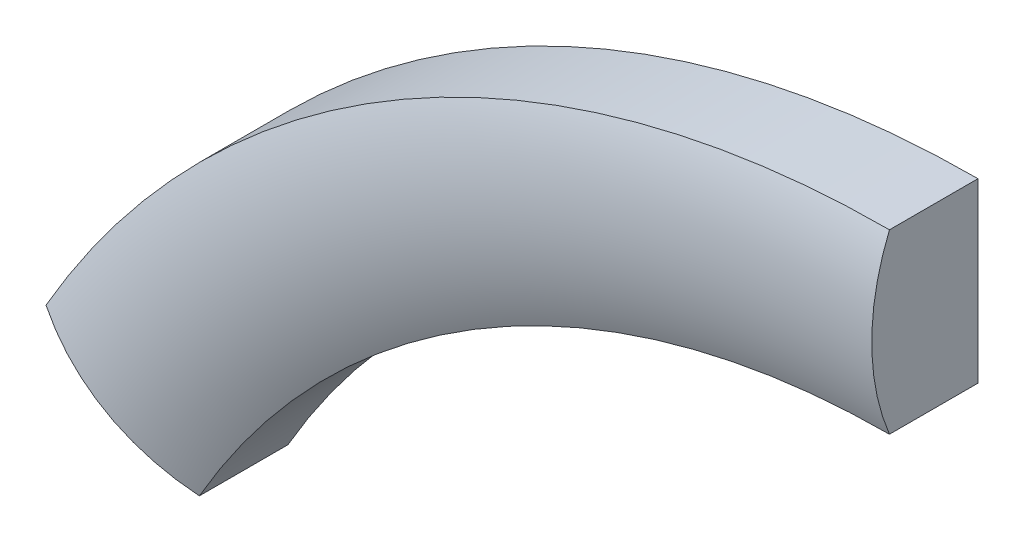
SolidWorks part; units mm, degrees
ref_plane "Vorne" through (0, 0, 0) normal (0, 0, 1) x (1, 0, 0)
ref_plane "Oben" through (0, 0, 0) normal (0, 1, 0) x (1, 0, 0)
ref_plane "Rechts" through (0, 0, 0) normal (1, 0, 0) x (0, 0, -1)
sketch "Skizze1" plane through (0, 0, 0) normal (0, 0, 1) x (1, 0, 0)
  line L0 (0, 0) -> (220.0986, 0) construction
  line L1 (0, 0) -> (-433.0127, -250) construction
  line L3 (-433.0127, -250) -> (-519.6152, -300) construction
  line L4 (-433.0127, -250) -> (-438.0127, -258.6603)
  arc A0 (0, 0) -> (-433.0127, -250) centre (0, -500) ccw
  dimension "D1" = 500
  dimension "D2" = 60
  dimension "D3" = 100
  dimension "D4" = 10
ref_plane "Ebene1" through (0, 0, 0) normal (-1, 0, 0) x (0, 0, 1)
sketch "Skizze2" plane through (0, 0, 0) normal (-1, 0, 0) x (0, 0, 1)
  line L1 (50, -50) -> (0, -50)
  line L3 (50, 50) -> (0, 50)
  line L4 (0, -50) -> (0, 50)
  arc A0 (50, 50) -> (50, -50) centre (-70, 0) cw
  dimension "D1" = 100
  dimension "D2" = 50
  dimension "D3" = 60
sweep "Austragung1" add profiles "Skizze2" path "Skizze1"
ref_plane "Ebene2" through (-519.6152, -300, 0) normal (-0.866, -0.5, 0) x (0.5, -0.866, 0)
sketch "Skizze4" plane through (0, 0, 0) normal (0, 0, -1) x (-1, 0, 0)
  circle A0 centre (17.8294, 0) radius 0.5
  dimension "D1" = 1
extrude "Linear austragen1" add sketch "Skizze4" along normal blind 0.1
sketch "Skizze3" plane through (-519.6152, -300, 0) normal (-0.866, -0.5, 0) x (0.5, -0.866, 0)
  line L5 (-216.9873, 70) -> (148.3975, 70)
  line L8 (-216.9873, 70) -> (-216.9873, 0)
  line L9 (-216.9873, 0) -> (148.3975, 0)
  line L10 (148.3975, 70) -> (148.3975, 0)
  line L12 (-116.9873, 0) -> (-43.3013, 0) construction
  line L13 (48.3975, 0) -> (48.3975, 50) construction
  dimension "D1" = 70
  dimension "D2" = 100
  dimension "D3" = 100
extrude "Schnitt-Linear austragen1" cut sketch "Skizze3" against normal up to surface (185.6773 mm away)
